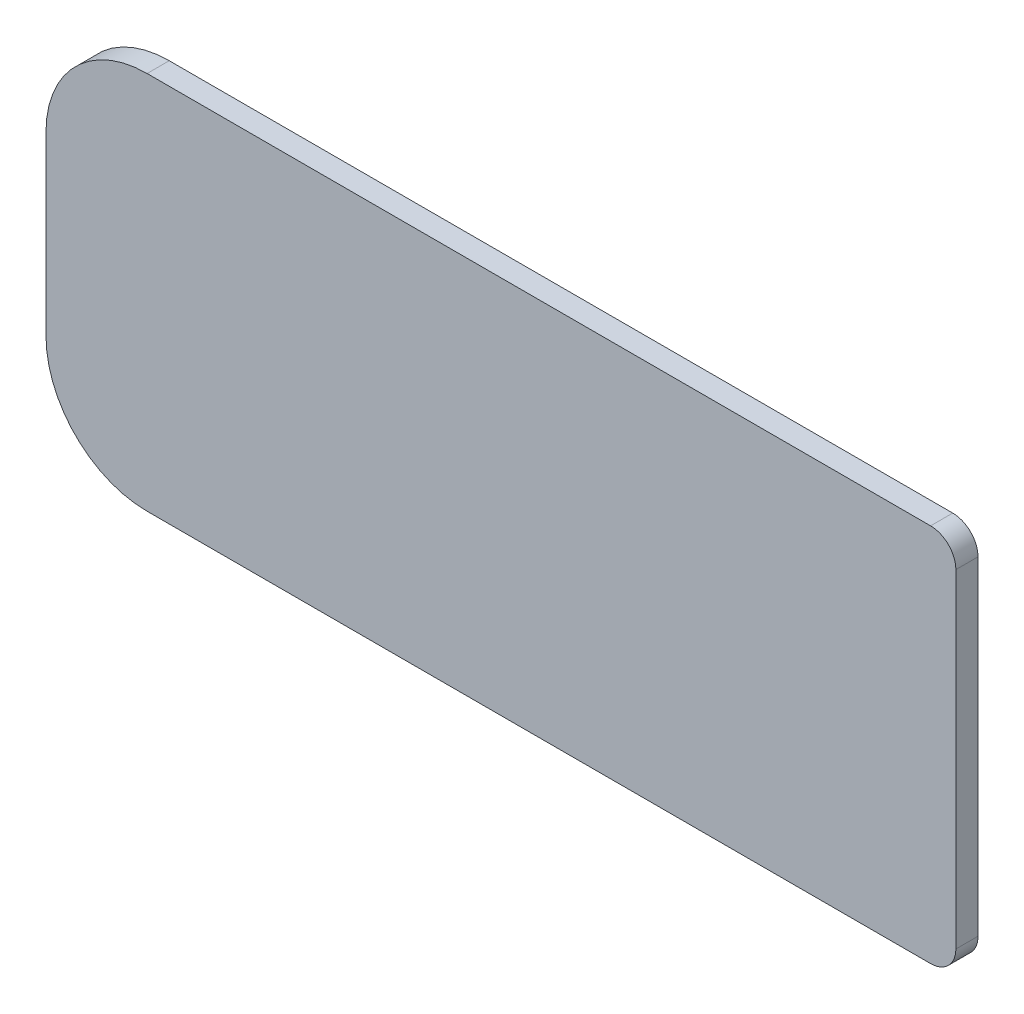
SolidWorks part; units mm, degrees
ref_plane "Front Plane" through (0, 0, 0) normal (0, 0, 1) x (1, 0, 0)
ref_plane "Top Plane" through (0, 0, 0) normal (0, 1, 0) x (1, 0, 0)
ref_plane "Right Plane" through (0, 0, 0) normal (1, 0, 0) x (0, 0, -1)
sketch "Sketch1" plane through (0, 0, 0) normal (0, 0, 1) x (1, 0, 0)
  line L0 (0, -95.25) -> (457.2, -95.25)
  line L1 (457.2, -95.25) -> (457.2, 95.25)
  line L2 (457.2, 95.25) -> (0, 95.25)
  line L3 (0, -95.25) -> (0, 0)
  line L4 (0, 0) -> (0, 95.25)
  dimension "D1" = 190.5
  dimension "D2" = 457.2
sketch "Sketch2" plane through (0, 0, 0) normal (0, 0, 1) x (1, 0, 0)
  line L0 (0, -95.25) -> (457.2, -95.25) construction
  line L1 (457.2, -95.25) -> (457.2, 95.25) construction
  line L2 (457.2, 95.25) -> (0, 95.25) construction
  line L3 (0, 0) -> (0, 95.25) construction
  line L4 (0, -95.25) -> (0, 0) construction
  line L5 (0, -95.25) -> (457.2, -95.25)
  line L6 (457.2, -95.25) -> (457.2, 95.25)
  line L7 (457.2, 95.25) -> (0, 95.25)
  line L8 (0, 0) -> (0, 95.25)
  line L9 (0, -95.25) -> (0, 0)
extrude "Boss-Extrude1" add sketch "Sketch2" along normal blind 11.1252
fillet "Fillet1" radius 50.8 2 edges at (0, 95.25, 5.5626) (0, -95.25, 5.5626)
fillet "Fillet2" radius 12.7 2 edges at (457.2, 95.25, 5.5626) (457.2, -95.25, 5.5626)
